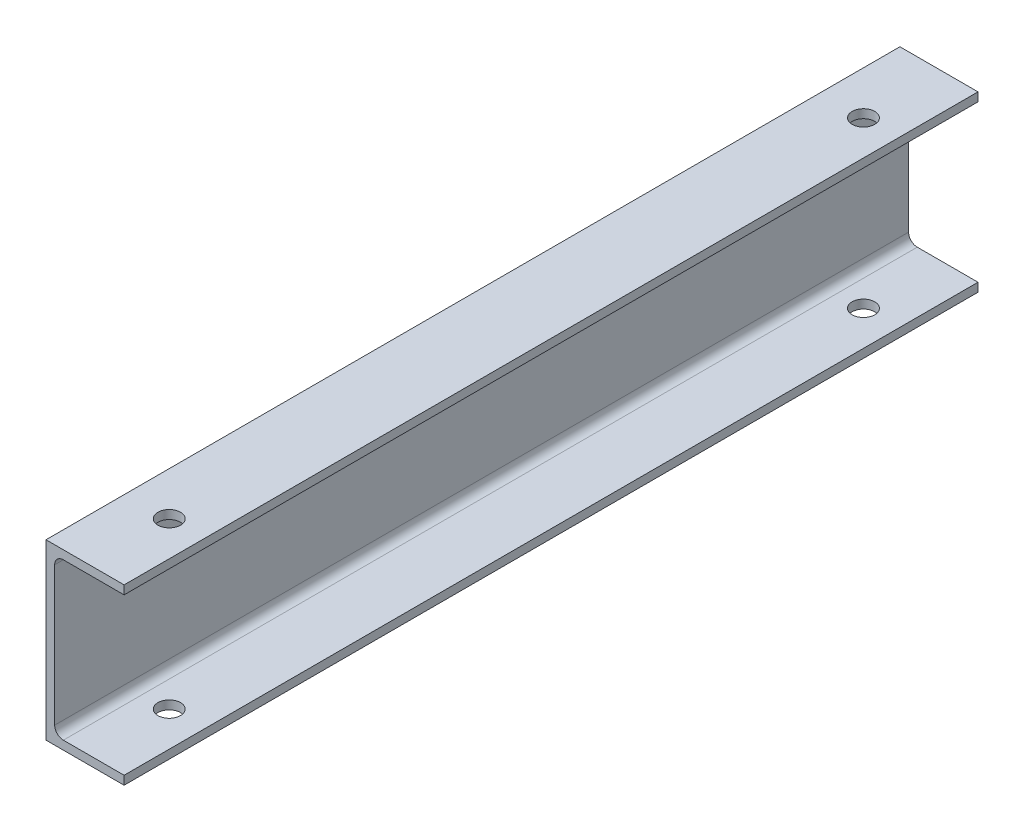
SolidWorks part; units mm, degrees
ref_plane "前视基准面" through (0, 0, 0) normal (0, 0, 1) x (1, 0, 0)
ref_plane "上视基准面" through (0, 0, 0) normal (0, 1, 0) x (1, 0, 0)
ref_plane "右视基准面" through (0, 0, 0) normal (1, 0, 0) x (0, 0, -1)
sketch "草图1" plane through (0, 0, 0) normal (0, 0, 1) x (1, 0, 0)
  line L0 (0, 0) -> (0, -100)
  line L1 (0, -100) -> (45, -100)
  line L2 (45, -100) -> (45, -95)
  line L3 (45, -95) -> (10, -95)
  line L4 (5, -90) -> (5, -10)
  line L5 (10, -5) -> (45, -5)
  line L6 (45, -5) -> (45, 0)
  line L7 (45, 0) -> (0, 0)
  arc A0 (5, -90) -> (10, -95) centre (10, -90) ccw
  arc A1 (5, -10) -> (10, -5) centre (10, -10) cw
  dimension "D1" = 5
extrude "凸台-拉伸1" add sketch "草图1" along normal blind 492
sketch "草图2" plane through (0, 0, 0) normal (0, 1, 0) x (1, 0, 0)
  line L0 (0, -492) -> (0, 0) construction
  line L1 (45, 0) -> (0, 0) construction
  circle A0 centre (25, -46) radius 6.5
  circle A1 centre (25, -446) radius 6.5
  dimension "D1" = 25
  dimension "D2" = 25
  dimension "D3" = 46
  dimension "D4" = 400
extrude "切除-拉伸1" cut sketch "草图2" against normal blind 100
